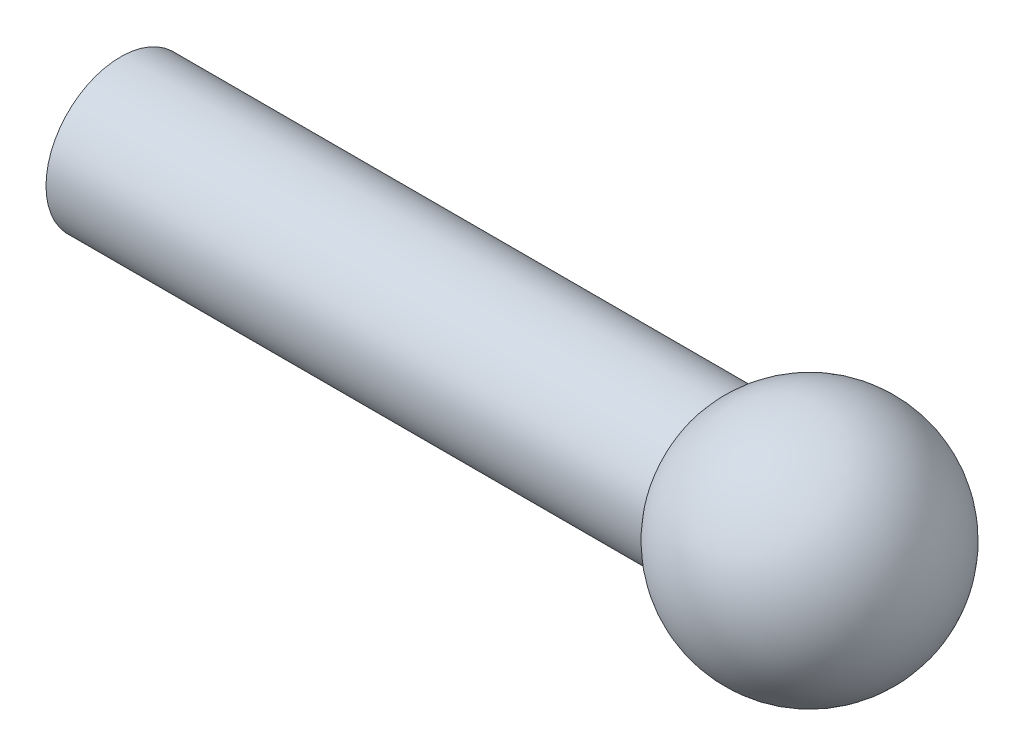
SolidWorks part; units mm, degrees
ref_plane "Plan de face" through (0, 0, 0) normal (0, 0, 1) x (1, 0, 0)
ref_plane "Plan de dessus" through (0, 0, 0) normal (0, 1, 0) x (1, 0, 0)
ref_plane "Plan de droite" through (0, 0, 0) normal (1, 0, 0) x (0, 0, -1)
sketch "Esquisse1" plane through (0, 0, 0) normal (0, 0, 1) x (1, 0, 0)
  line L0 (-13.4345, 0) -> (71.4714, 0) construction
  line L1 (0, 0) -> (0, 2.5)
  line L2 (0, 2.5) -> (20, 2.5)
  line L3 (27.1225, 0) -> (0, 0)
  arc A0 (27.1225, 0) -> (20, 2.5) centre (23.1225, 0) ccw
  dimension "D3" = 8
  dimension "D1" = 5
  dimension "D2" = 20
revolve "Révolution1" add sketch "Esquisse1" angle 360 about L0
